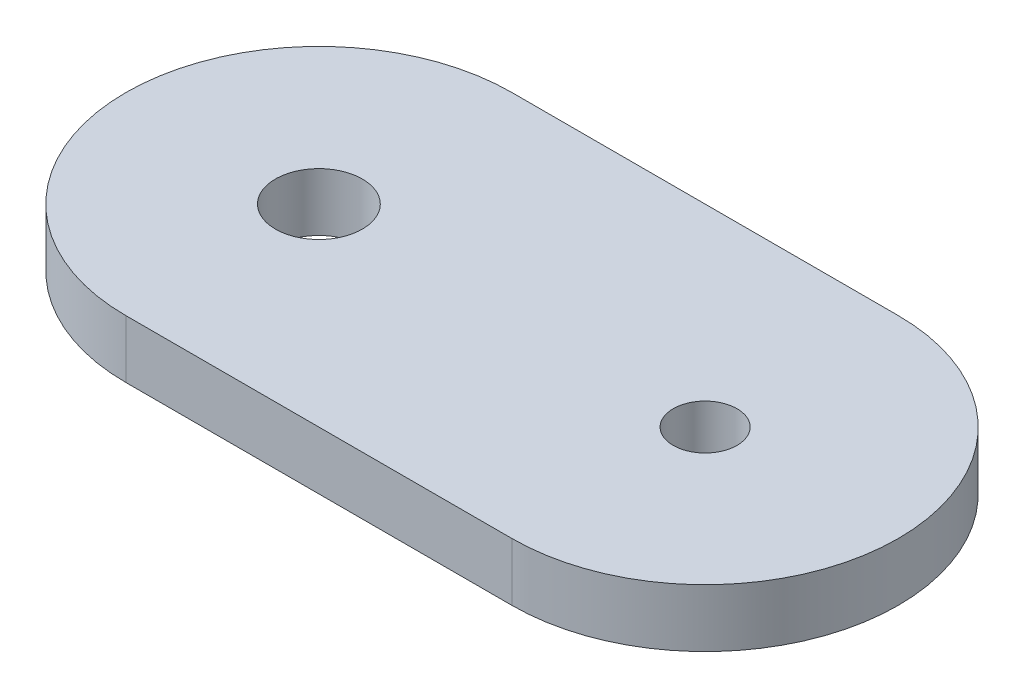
SolidWorks part; units mm, degrees
ref_plane "Front Plane" through (0, 0, 0) normal (0, 0, 1) x (1, 0, 0)
ref_plane "Top Plane" through (0, 0, 0) normal (0, 1, 0) x (1, 0, 0)
ref_plane "Right Plane" through (0, 0, 0) normal (1, 0, 0) x (0, 0, -1)
sketch "Sketch1" plane through (0, 0, 0) normal (0, 1, 0) x (1, 0, 0)
  line L0 (0, 0) -> (20, 0) construction
  line L1 (0, 10) -> (20, 10)
  line L2 (20, -10) -> (0, -10)
  arc A0 (0, 10) -> (0, -10) centre (0, 0) ccw
  arc A1 (20, -10) -> (20, 10) centre (20, 0) ccw
  dimension "D1" = 10
  dimension "D2" = 20
extrude "Boss-Extrude1" add sketch "Sketch1" along normal blind 3
sketch "Sketch2" plane through (0, 3, 0) normal (0, 1, 0) x (1, 0, 0)
  point P0 (20, 0)
hole_wizard "M4 Tapped Hole1" positions "3DSketch1" profile "Sketch3" tap size "M4" standard "DIN"
sketch3d "3DSketch1"
  point P0 (20, 3, 0)
sketch "Sketch3" plane through (20, 3, 0) normal (1, 0, 0) x (0, 0, 1)
  line L0 (0, 0) -> (0, 3)
  line L1 (0, 3) -> (1.65, 3)
  line L2 (1.65, 3) -> (1.65, 0)
  line L5 (1.65, 0) -> (0, 0)
  line L11 (0, -6.35) -> (0, 107.95) construction
  dimension "Thru Tap Drill Dia." = 3.3
  dimension "Thru Tap Drill Depth" = 3
sketch "Sketch4" plane through (0, 3, 0) normal (0, 1, 0) x (1, 0, 0)
  point P0 (0, 0)
hole_wizard "Ø4.5 (4.5) Diameter Hole1" positions "3DSketch2" profile "Sketch5" hole size "Ø4.5" standard "ISO"
sketch3d "3DSketch2"
  point P0 (0, 3, 0)
sketch "Sketch5" plane through (0, 3, 0) normal (1, 0, 0) x (0, 0, 1)
  line L0 (0, 0) -> (0, 3)
  line L1 (0, 3) -> (2.25, 3)
  line L2 (2.25, 3) -> (2.25, 0)
  line L5 (2.25, 0) -> (0, 0)
  line L11 (0, -6.35) -> (0, 107.95) construction
  dimension "Thru Hole Dia." = 4.5
  dimension "Thru Hole Depth" = 3
